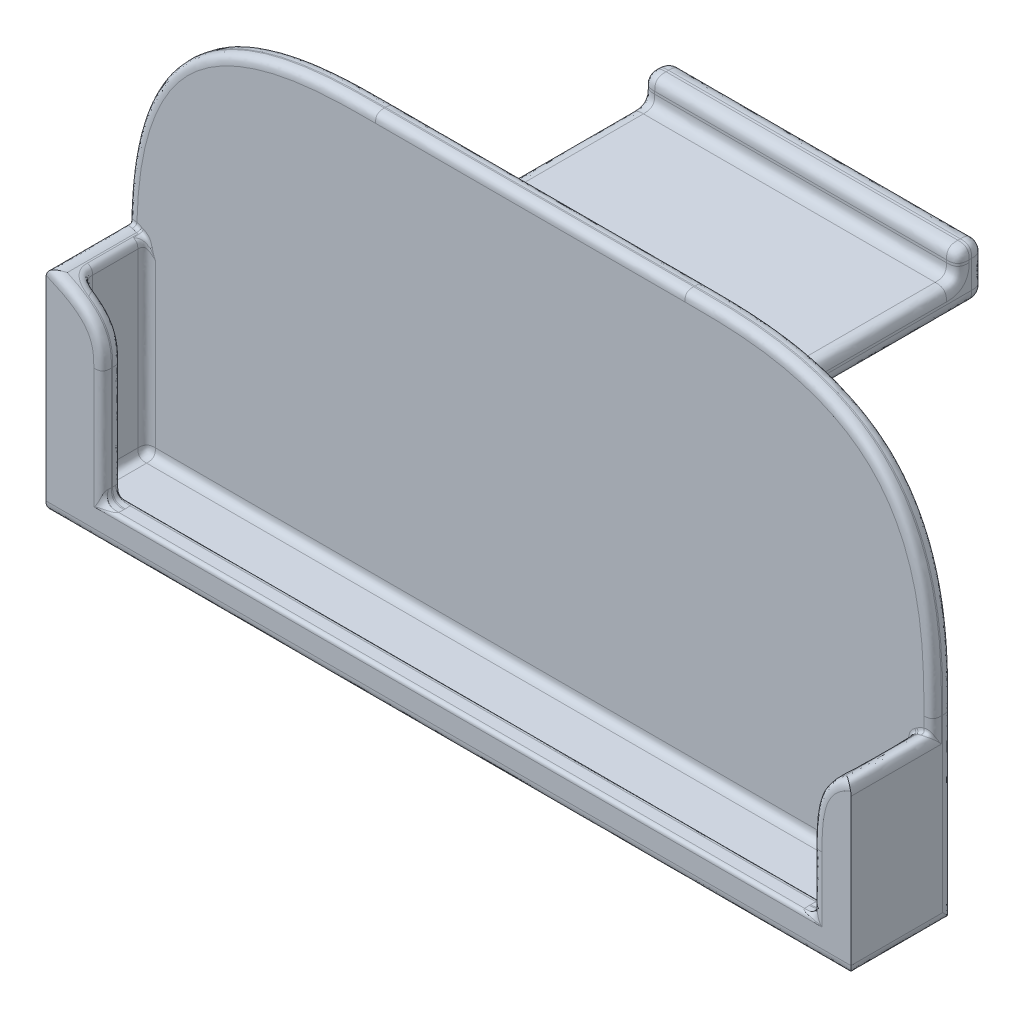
SolidWorks part; units mm, degrees
ref_plane "Front Plane" through (0, 0, 0) normal (0, 0, 1) x (1, 0, 0)
ref_plane "Top Plane" through (0, 0, 0) normal (0, 1, 0) x (1, 0, 0)
ref_plane "Right Plane" through (0, 0, 0) normal (1, 0, 0) x (0, 0, -1)
sketch "Sketch1" plane through (0, 0, 0) normal (0, 0, 1) x (1, 0, 0)
  line L1 (-77.47, -39.37) -> (77.47, -39.37)
  line L2 (-77.47, -39.37) -> (-77.47, 0)
  line L4 (77.47, -39.37) -> (77.47, -8.89)
  line L5 (-77.47, -39.37) -> (0, 0) construction
  line L6 (0, 0) -> (77.47, -39.37) construction
  line L7 (81.28, -43.18) -> (81.28, -8.89)
  line L8 (-81.28, -43.18) -> (81.28, -43.18)
  line L9 (-81.28, -43.18) -> (-81.28, 0)
  line L10 (-77.47, 0) -> (-81.28, 0)
  line L11 (81.28, -8.89) -> (77.47, -8.89)
  line L12 (-77.47, -39.37) -> (-77.47, 39.37) construction
  line L13 (-77.47, 39.37) -> (77.47, 39.37) construction
  line L14 (-81.28, 43.18) -> (81.28, 43.18) construction
  line L15 (-81.28, -43.18) -> (-81.28, 43.18) construction
  line L16 (77.47, -39.37) -> (77.47, 39.37) construction
  line L17 (81.28, -43.18) -> (81.28, 43.18) construction
  point P0 (0, 0)
  dimension "D1" = 154.94
  dimension "D2" = 30.48
  dimension "D3" = 3.81
extrude "Boss-Extrude1" add sketch "Sketch1" along normal blind 12.7
sketch "Sketch2" plane through (0, 0, 0) normal (0, 0, -1) x (-1, 0, 0)
  line L1 (-81.28, 43.18) -> (81.28, 43.18)
  line L2 (-81.28, 43.18) -> (-81.28, -43.18)
  line L3 (-81.28, -43.18) -> (81.28, -43.18)
  line L4 (81.28, 43.18) -> (81.28, -43.18)
  line L5 (-81.28, 43.18) -> (81.28, -43.18) construction
  line L6 (-81.28, -43.18) -> (81.28, 43.18) construction
  point P0 (0, 0)
extrude "Boss-Extrude2" add sketch "Sketch2" along normal blind 3.81
sketch "Sketch3" plane through (0, 0, 12.7) normal (0, 0, 1) x (1, 0, 0)
  line L0 (-77.47, 0) -> (-69.85, 0)
  line L1 (-69.85, 0) -> (-69.85, -36.83)
  line L2 (-69.85, -36.83) -> (73.66, -36.83)
  line L3 (73.66, -36.83) -> (73.66, -8.89)
  line L4 (73.66, -8.89) -> (77.47, -8.89)
  line L8 (-77.47, -39.37) -> (-77.47, 0)
  line L9 (-77.47, 0) -> (-81.28, 0)
  line L10 (-81.28, 0) -> (-81.28, -43.18)
  line L11 (-81.28, -43.18) -> (81.28, -43.18)
  line L12 (81.28, -43.18) -> (81.28, -8.89)
  line L13 (81.28, -8.89) -> (77.47, -8.89)
  line L14 (77.47, -8.89) -> (77.47, -39.37)
  line L15 (77.47, -39.37) -> (-77.47, -39.37)
  line L17 (-77.47, 0) -> (-81.28, 0)
  line L18 (-81.28, 0) -> (-81.28, -43.18)
  line L19 (-81.28, -43.18) -> (81.28, -43.18)
  line L20 (81.28, -43.18) -> (81.28, -8.89)
  line L21 (81.28, -8.89) -> (77.47, -8.89)
  dimension "D2" = 7.62
  dimension "D3" = 7.62
  dimension "D4" = 6.35
  dimension "D1" = 0
extrude "Boss-Extrude3" add sketch "Sketch3" along normal blind 3.81
fillet "Fillet14" radius 14.478 2 edges at (73.66, -8.89, 14.605) (-69.85, 0, 14.605)
fillet "Fillet15" radius 1.778 8 edges at (77.47, -39.37, 6.35) (0, -39.37, 12.7) (-77.47, -39.37, 6.35) (0, -39.37, 0)
fillet "Fillet16" radius 1.778 16 edges
fillet "Fillet17" radius 50.038 2 edges at (-81.28, 43.18, -1.905) (81.28, 43.18, -1.905)
fillet "Fillet18" radius 1.778 12 edges at (-81.28, -43.18, 6.35) (0, -43.18, 16.51) (81.28, -43.18, 6.35)
fillet "Fillet20" radius 0.762 2 edges
fillet "Fillet21" radius 2.54 10 edges
fillet "Fillet24" radius 0.762 11 edges
sketch "Sketch4" plane through (0, 0, -3.81) normal (0, 0, -1) x (-1, 0, 0)
  line L1 (-31.75, 12.7) -> (31.75, 12.7)
  line L2 (-31.75, 12.7) -> (-31.75, 17.78)
  line L3 (-31.75, 17.78) -> (31.75, 17.78)
  line L4 (31.75, 12.7) -> (31.75, 17.78)
  line L5 (-31.75, 12.7) -> (31.75, 17.78) construction
  line L6 (-31.75, 17.78) -> (31.75, 12.7) construction
  point P0 (0, 15.24)
  point P5 (0, 0)
  dimension "D1" = 5.08
  dimension "D2" = 63.5
  dimension "D3" = 17.78
extrude "Boss-Extrude4" add sketch "Sketch4" along normal blind 50.8
sketch "Sketch6" plane through (0, 12.7, 0) normal (0, -1, 0) x (1, 0, 0)
  line L0 (31.75, -54.61) -> (31.75, -3.81) construction
  line L1 (-31.75, -54.61) -> (31.75, -54.61)
  line L2 (-31.75, -54.61) -> (-31.75, -59.69)
  line L3 (-31.75, -59.69) -> (31.75, -59.69)
  line L4 (31.75, -54.61) -> (31.75, -59.69)
  dimension "D1" = 5.08
extrude "Boss-Extrude5" add sketch "Sketch6" against normal blind 10.16
fillet "Fillet25" radius 8.382 4 edges at (31.75, 15.24, -3.81) (-31.75, 15.24, -3.81) (0, 12.7, -3.81) (0, 17.78, -3.81)
fillet "Fillet26" radius 2.286 18 edges at (-31.75, 20.32, -54.61) (31.75, 20.32, -54.61) (31.75, 17.78, -59.69) (-31.75, 17.78, -59.69) (0, 12.7, -59.69) (0, 22.86, -59.69) (0, 17.78, -54.61) (0, 22.86, -54.61) (31.75, 22.86, -57.15) (-31.75, 22.86, -57.15)
